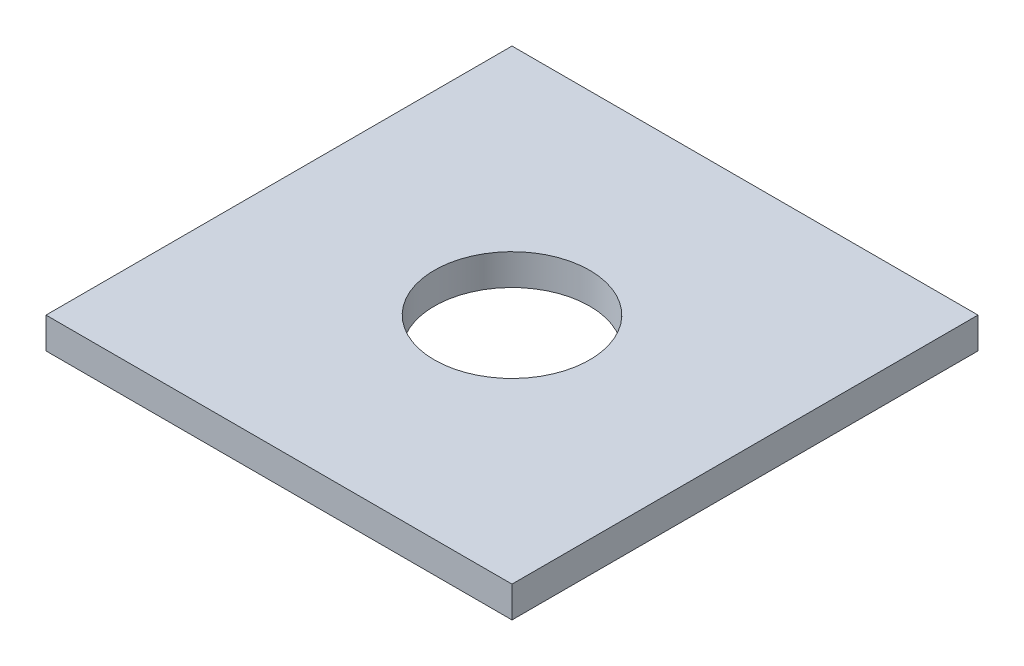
SolidWorks part; units mm, degrees
ref_plane "Plane1" through (0, 0, 0) normal (0, 0, 1) x (1, 0, 0)
ref_plane "Plane2" through (0, 0, 0) normal (0, 1, 0) x (1, 0, 0)
ref_plane "Plane3" through (0, 0, 0) normal (1, 0, 0) x (0, 0, -1)
sketch "Sketch1" plane through (0, 0, 0) normal (0, 0, 1) x (1, 0, 0)
  line L0 (-45, 0) -> (-45, 6)
  line L1 (-45, 6) -> (45, 6)
  line L2 (45, 6) -> (45, 0)
  line L3 (45, 0) -> (-45, 0)
  dimension "SquareSize" = 90
  dimension "Thickness" = 6
extrude "Base-Extrude" add sketch "Sketch1" along normal mid plane 90
sketch "Sketch2" plane through (0, 6, 0) normal (0, 1, 0) x (-1, 0, 0)
  circle A0 centre (0, 0) radius 15
  dimension "HoleDia" = 30
extrude "Cut-Extrude1" cut sketch "Sketch2" against normal through all
equation "\"D1@Base-Extrude\" = \"SquareSize@Sketch1\""
